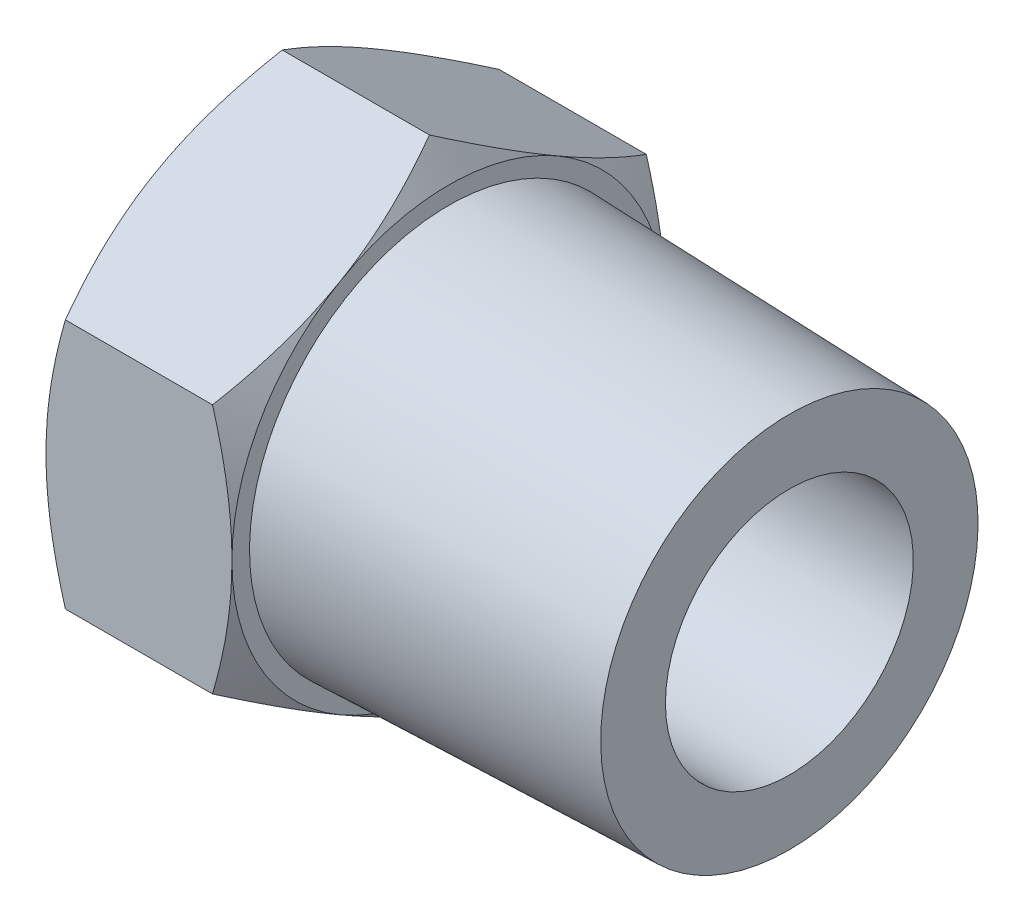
SolidWorks part; units mm, degrees
ref_plane "Front Plane" through (0, 0, 0) normal (0, 0, 1) x (1, 0, 0)
ref_plane "Top Plane" through (0, 0, 0) normal (0, 1, 0) x (1, 0, 0)
ref_plane "Right Plane" through (0, 0, 0) normal (1, 0, 0) x (0, 0, -1)
imported_body "Imported1"
hole_wizard "1/16 NPT Tapped Hole1" positions "Sketch1" profile "Sketch2" size "1/16" standard "ANSI Inch"
sketch "Sketch1" plane through (0, 0, 0) normal (-1, 0, 0) x (0, 0, 1)
  point P0 (0, 0)
sketch "Sketch2" plane through (0, 0, 0) normal (0, 1, 0) x (0, 0, 1)
  line L0 (0, 0) -> (0, 13.4874)
  line L1 (0, 13.4874) -> (3.175, 13.4874)
  line L2 (-4.0317, 6.8859) -> (-4.2379, 0) construction
  line L3 (3.175, 13.4874) -> (3.175, 6.8859)
  line L4 (3.175, 6.8859) -> (4.0317, 6.8859)
  line L5 (4.0317, 6.8859) -> (4.2379, 0)
  line L7 (4.2379, 0) -> (0, 0)
  line L8 (0, -6.35) -> (0, 107.95) construction
  line L11 (-3.175, 6.8859) -> (-4.0317, 6.8859) construction
  dimension "Thru Tap Drill Dia." = 6.35
  dimension "Thru Tap Drill Depth" = 13.4874
  dimension "Thread Dia." = 8.4758
  dimension "Thread Angle" = 3.43
  dimension "Thread Depth" = 6.8859
